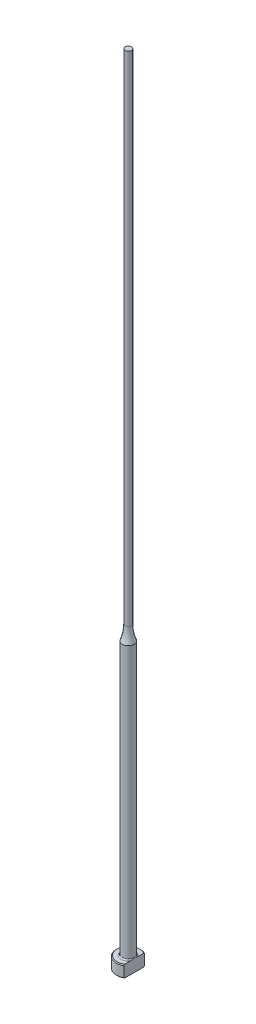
SolidWorks part; units mm, degrees
ref_plane "Front Plane" through (0, 0, 0) normal (0, 0, 1) x (1, 0, 0)
ref_plane "Top Plane" through (0, 0, 0) normal (0, 1, 0) x (1, 0, 0)
ref_plane "Right Plane" through (0, 0, 0) normal (1, 0, 0) x (0, 0, -1)
sketch "Sketch1" plane through (0, 0, 0) normal (0, 0, 1) x (1, 0, 0)
  line L0 (0, 259.9588) -> (0, -15.1925) construction
  line L1 (0, 0) -> (-3, 0)
  line L2 (-3, 0) -> (-3, 3)
  line L3 (-3, 3) -> (-1.5, 3)
  line L4 (-0.8, 75) -> (-0.8, 200)
  line L5 (-0.8, 200) -> (0, 200)
  line L6 (0, 200) -> (0, 0)
  line L7 (-1.5, 3) -> (-1.5, 71.3244)
  arc A0 (-1.5, 71.3244) -> (-0.8, 75) centre (-10.8, 75) ccw
  point P13 (-1.5, 0)
  dimension "D1" = 10
  dimension "L" = 200
  dimension "H" = 6
  dimension "T" = 3
  dimension "D" = 1.6
  dimension "B" = 3
  dimension "S" = 75
revolve "Revolve1" add sketch "Sketch1" angle 360 about L0
chamfer "Chamfer1" distance 0.2 angle 45 2 edges at (0, 3, 3) (0, 0, 3)
fillet "Fillet1" radius 0.3 1 edges at (0, 3, 1.5)
sketch "Sketch2" plane through (0, 0, 0) normal (0, 1, 0) x (1, 0, 0)
  line L0 (1.5, 2.5981) -> (1.5, -2.5981)
  circle A0 centre (0, 0) radius 3 construction
  arc A1 (1.5, -2.5981) -> (1.5, 2.5981) centre (0, 0) ccw
  circle A2 centre (0, 0) radius 1.5 construction
extrude "KEY" cut sketch "Sketch2" along normal through all
